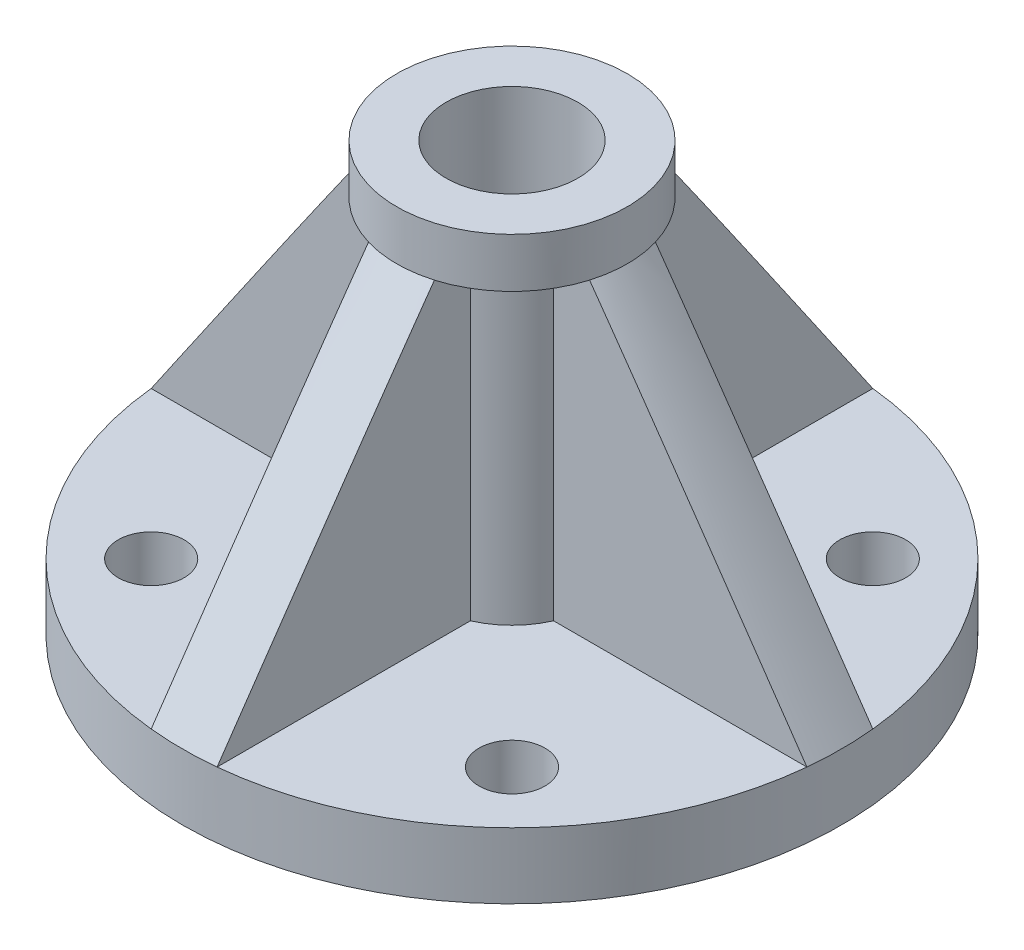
SolidWorks part; units mm, degrees
ref_plane "Front Plane" through (0, 0, 0) normal (0, 0, 1) x (1, 0, 0)
ref_plane "Top Plane" through (0, 0, 0) normal (0, 1, 0) x (1, 0, 0)
ref_plane "Right Plane" through (0, 0, 0) normal (1, 0, 0) x (0, 0, -1)
sketch "Sketch1" plane through (0, 0, 0) normal (0, 0, 1) x (1, 0, 0)
  line L0 (-10, 0) -> (-10, 65)
  line L1 (-10, 65) -> (-17.5, 65)
  line L2 (-17.5, 57.5) -> (-50, 10)
  line L3 (-50, 10) -> (-50, 0)
  line L4 (0, 0) -> (0, 82.6885) construction
  line L5 (-50, 0) -> (-10, 0)
  line L6 (-17.5, 65) -> (-17.5, 57.5)
  dimension "D1" = 20
  dimension "D2" = 55
  dimension "D3" = 40
  dimension "D4" = 55
  dimension "D5" = 7.5
  dimension "D6" = 10
  dimension "D7" = 7.5
revolve "Revolve1" add sketch "Sketch1" angle 360 about L4
ref_plane "Plane1" through (0, 57.5, 0) normal (0, 1, 0) x (-1, 0, 0)
sketch "Sketch2" plane through (0, 57.5, 0) normal (0, 1, 0) x (-1, 0, 0)
  line L0 (0, 0) -> (-50, 0) construction
  line L1 (0, 0) -> (0, 50) construction
  line L2 (-5, 11.3127) -> (-5, 49.7494)
  line L3 (-11.3127, 5) -> (-49.7494, 5)
  line L4 (-5, 5) -> (-50, 5) construction
  line L5 (-5, 5) -> (-5, 50) construction
  circle A0 centre (0, 0) radius 50 construction
  arc A1 (-5, 49.7494) -> (-49.7494, 5) centre (0, 0) ccw
  circle A2 centre (0, 0) radius 12.3684 construction
  arc A3 (-5, 11.3127) -> (-11.3127, 5) centre (0, 0) ccw
  dimension "D1" = 5
extrude "Cut-Extrude1" cut sketch "Sketch2" against normal offset from surface (47.5 mm away) 10
hole_wizard "Ø10.0 (10) Diameter Hole1" positions "Sketch4" profile "Sketch5" hole size "Ø10.0" standard "Ansi Metric"
sketch "Sketch4" plane through (0, 10, 0) normal (0, 1, 0) x (-1, 0, 0)
  line L0 (-5, 49.7494) -> (-49.7494, 5) construction
  arc A0 (-5, 49.7494) -> (-49.7494, 5) centre (0, 0) ccw construction
  point P0 (-27.3747, 27.3747)
sketch "Sketch5" plane through (27.3747, 10, 27.3747) normal (1, 0, 0) x (0, 0, 1)
  line L0 (0, 0) -> (0, 10)
  line L1 (0, 10) -> (5, 10)
  line L2 (5, 10) -> (5, 0)
  line L5 (5, 0) -> (0, 0)
  line L11 (0, -6.35) -> (0, 107.95) construction
  dimension "Thru Hole Dia." = 10
  dimension "Thru Hole Depth" = 10
pattern_circular "CirPattern1" count 4 over 360 about axis through (0, 0, 0) along (0, 1, 0) of "Cut-Extrude1", "Ø10.0 (10) Diameter Hole1"
